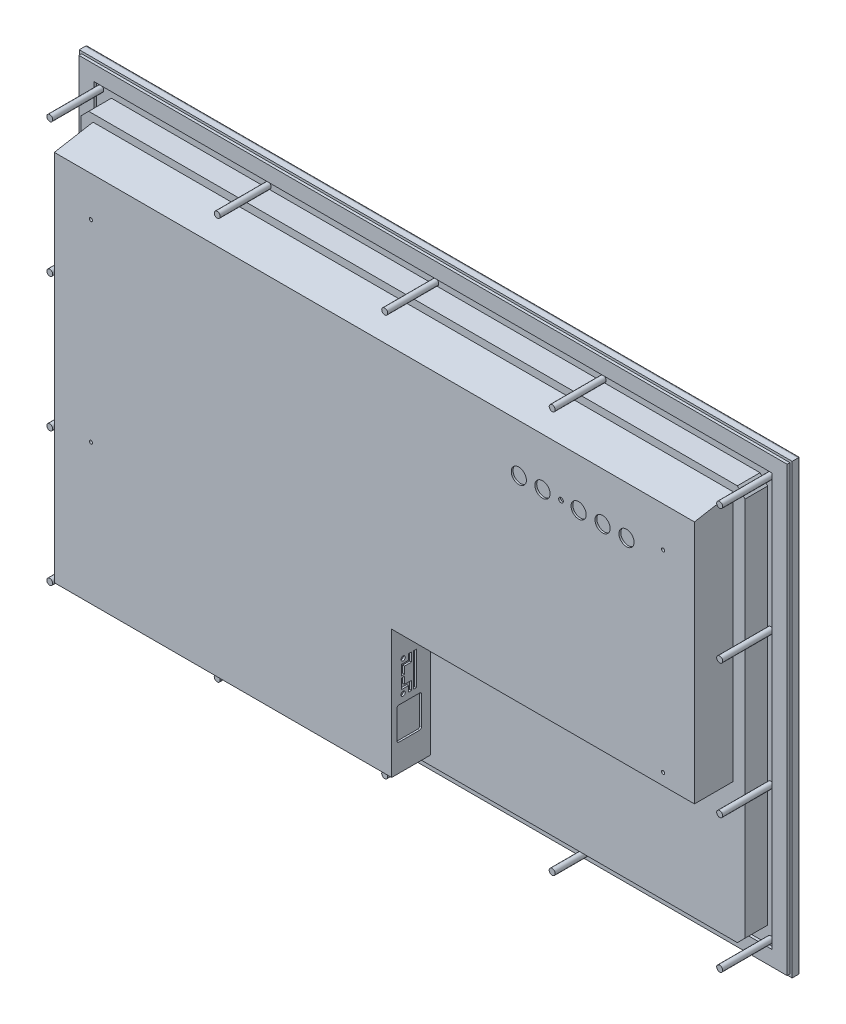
SolidWorks part; units mm, degrees
ref_plane "Front Plane" through (0, 0, 0) normal (0, 0, 1) x (1, 0, 0)
ref_plane "Top Plane" through (0, 0, 0) normal (0, 1, 0) x (1, 0, 0)
ref_plane "Right Plane" through (0, 0, 0) normal (1, 0, 0) x (0, 0, -1)
sketch "Sketch1" plane through (0, 0, 0) normal (0, 0, 1) x (1, 0, 0)
  line L0 (-298.45, 187.325) -> (298.45, 187.325)
  line L1 (298.45, 187.325) -> (298.45, -187.325)
  line L2 (298.45, -187.325) -> (-298.45, -187.325)
  line L3 (-298.45, -187.325) -> (-298.45, 187.325)
  point P2 (0, -187.325)
  point P3 (298.45, 0)
  dimension "D1" = 596.9
  dimension "D2" = 374.65
extrude "Bezel" add sketch "Sketch1" against normal blind 7.112
fillet "Bezel Radius" radius 2 4 edges at (0, -187.325, -7.112) (0, 187.325, -7.112) (-298.45, 0, -7.112) (298.45, 0, -7.112)
sketch "Sketch2" plane through (0, 0, -7.112) normal (0, 0, -1) x (-1, 0, 0)
  line L0 (-256.7686, 145.2626) -> (256.7686, 145.2626)
  line L1 (256.7686, 145.2626) -> (256.7686, -145.2626)
  line L2 (256.7686, -145.2626) -> (-256.7686, -145.2626)
  line L3 (-256.7686, -145.2626) -> (-256.7686, 145.2626)
  line L4 (296.45, 185.325) -> (-296.45, 185.325) construction
  line L5 (-296.45, 185.325) -> (-296.45, -185.325) construction
  point P0 (0, 145.2626)
  point P6 (0, 185.325)
  point P8 (-256.7686, 0)
  point P11 (-296.45, 0)
  dimension "D1" = 513.5372
  dimension "D2" = 290.5252
extrude "Window" cut sketch "Sketch2" against normal blind 2.35
sketch "Sketch3" plane through (0, 0, 0) normal (0, 0, 1) x (1, 0, 0)
  line L4 (-296.545, 185.42) -> (296.545, 185.42)
  line L5 (296.545, 185.42) -> (296.545, -185.42)
  line L6 (296.545, -185.42) -> (-296.545, -185.42)
  line L7 (-296.545, -185.42) -> (-296.545, 185.42)
  line L8 (298.45, 187.325) -> (-298.45, 187.325) construction
  line L9 (-298.45, 187.325) -> (-298.45, -187.325) construction
  line L10 (-298.45, -187.325) -> (298.45, -187.325) construction
  line L11 (298.45, -187.325) -> (298.45, 187.325) construction
  line L12 (-283.845, -172.72) -> (-283.845, 172.72)
  line L13 (-283.845, 172.72) -> (283.845, 172.72)
  line L14 (283.845, 172.72) -> (283.845, -172.72)
  line L15 (283.845, -172.72) -> (-283.845, -172.72)
  dimension "D1" = 1.905
  dimension "D2" = 1.905
  dimension "D3" = 1.905
  dimension "D4" = 1.905
  dimension "D5" = 12.7
extrude "Gasket" add sketch "Sketch3" along normal blind 2.3
sketch "Sketch5" plane through (0, 0, 0) normal (0, 0, 1) x (1, 0, 0)
  line L0 (-298.45, 187.325) -> (-298.45, -187.325) construction
  line L1 (298.45, 187.325) -> (-298.45, 187.325) construction
  circle A0 centre (-280.4668, 168.1226) radius 2.5
  circle A22 centre (-140.2334, 168.1226) radius 2.5
  circle A23 centre (-140.2334, -168.148) radius 2.5
  circle A24 centre (0, 168.1226) radius 2.5
  circle A25 centre (0, -168.148) radius 2.5
  circle A26 centre (140.2334, 168.1226) radius 2.5
  circle A27 centre (140.2334, -168.148) radius 2.5
  circle A28 centre (280.4668, 168.1226) radius 2.5
  circle A29 centre (280.4668, -168.148) radius 2.5
  circle A31 centre (-280.4668, -56.0578) radius 2.5
  circle A32 centre (-280.4668, -168.148) radius 2.5
  circle A33 centre (-280.4668, 56.0324) radius 2.5
  circle A34 centre (-280.4668, 56.0324) radius 2.5
  circle A35 centre (280.4668, 56.0324) radius 2.5
  circle A36 centre (-280.4668, -56.0578) radius 2.5
  circle A37 centre (280.4668, -56.0578) radius 2.5
  dimension "D1" = 5
  dimension "D2" = 17.9832
  dimension "D3" = 19.2024
  dimension "D4" = 3
  dimension "D5" = 140.2334
  dimension "D6" = 5
  dimension "D7" = 4
  dimension "D8" = 112.0902
extrude "Panel Frame Studs" add sketch "Sketch5" along normal blind 42.7
sketch "Sketch6" plane through (0, 0, 0) normal (0, 0, 1) x (1, 0, 0)
  line L0 (-277.9668, 159.2107) -> (-271.5549, 165.6226)
  line L1 (-271.5549, 165.6226) -> (271.5549, 165.6226)
  line L2 (271.5549, 165.6226) -> (277.9668, 159.2107)
  line L3 (277.9668, 159.2107) -> (277.9668, -159.2361)
  line L4 (277.9668, -159.2361) -> (271.5549, -165.648)
  line L5 (271.5549, -165.648) -> (-271.5549, -165.648)
  line L6 (-271.5549, -165.648) -> (-277.9668, -159.2361)
  line L7 (-277.9668, -159.2361) -> (-277.9668, 159.2107)
  circle A0 centre (-280.4668, 168.1226) radius 2.5 construction
  circle A6 centre (280.4668, 56.0324) radius 2.5 construction
  circle A7 centre (-140.2334, -168.148) radius 2.5 construction
  dimension "D1" = 9.0678
  dimension "D2" = 45
extrude "Body" add sketch "Sketch6" along normal blind 18.9738 separate body
sketch "Sketch7" plane through (0, 0, 18.9738) normal (0, 0, 1) x (1, 0, 0)
  line L0 (-267.97, 159.5374) -> (267.97, 159.5374)
  line L1 (267.97, 159.5374) -> (267.97, -50.673)
  line L2 (267.97, -50.673) -> (14.478, -50.673)
  line L3 (14.478, -50.673) -> (14.478, -158.242)
  line L4 (14.478, -158.242) -> (-267.97, -158.242)
  line L5 (-267.97, -158.242) -> (-267.97, 159.5374)
  line L6 (-271.5549, -165.648) -> (271.5549, -165.648) construction
  line L7 (-298.45, -187.325) -> (298.45, -187.325) construction
  line L9 (-277.9668, 159.2107) -> (-277.9668, -159.2361) construction
  point P3 (0, 159.5374)
  dimension "D1" = 535.94
  dimension "D2" = 210.2104
  dimension "D3" = 253.492
  dimension "D4" = 107.569
  dimension "D5" = 29.083
extrude "Rear Cover" add sketch "Sketch7" along normal blind 32.3596
draft "Rear Cover Slope" type of draft neutral plane draft angle 10 faces to draft 1 parameters "D1"=10
sketch "Sketch10" plane through (0, -50.673, 0) normal (0, 1, 0) x (1, 0, 0)
  line L4 (267.97, -51.3334) -> (267.97, -18.9738) construction
  line L5 (14.478, -18.9738) -> (267.97, -18.9738) construction
  line L53 (129.3253, -42.3233) -> (129.3253, -37.2433)
  line L54 (105.0493, -45.4958) -> (126.2773, -45.4958)
  line L55 (105.0493, -34.0709) -> (126.2773, -34.0709)
  line L56 (102.0013, -37.2433) -> (102.0013, -42.3233)
  line L57 (163.4683, -38.5006) -> (163.4683, -43.5806)
  line L58 (146.1963, -46.7531) -> (160.4203, -46.7531)
  line L59 (143.1483, -38.5006) -> (143.1483, -43.5806)
  line L60 (146.1963, -35.3282) -> (160.2927, -35.3256)
  line L61 (193.5581, -37.0782) -> (193.5581, -42.1582)
  line L62 (210.8301, -33.9058) -> (196.6061, -33.9058)
  line L63 (213.8781, -42.1582) -> (213.8781, -37.0782)
  line L64 (196.6061, -45.3307) -> (210.7025, -45.3332)
  line L65 (247.3255, -33.5095) -> (231.3235, -33.5095)
  line L66 (247.3255, -41.193) -> (247.3255, -45.7015)
  line L67 (231.3235, -45.7015) -> (247.3255, -45.7015)
  line L68 (231.3235, -41.193) -> (231.3235, -45.7015)
  line L69 (226.8785, -41.193) -> (231.3235, -41.193)
  line L70 (226.8785, -38.018) -> (231.3235, -38.018)
  line L71 (231.3235, -33.5095) -> (231.3235, -38.018)
  line L72 (247.3255, -38.018) -> (247.3255, -33.5095)
  line L73 (247.3255, -41.193) -> (251.7705, -41.193)
  line L74 (247.3255, -38.018) -> (251.7705, -38.018)
  circle A42 centre (131.9193, -39.7833) radius 1.5875
  arc A43 (129.3253, -42.3233) -> (126.2773, -45.4958) centre (126.1503, -42.3233) cw
  arc A44 (126.2773, -34.0709) -> (129.3253, -37.2433) centre (126.1503, -37.2433) cw
  arc A45 (102.0013, -37.2433) -> (105.0493, -34.0709) centre (105.1763, -37.2433) cw
  arc A46 (105.0493, -45.4958) -> (102.0013, -42.3233) centre (105.1763, -42.3233) cw
  circle A47 centre (99.4073, -39.7833) radius 1.5875
  arc A48 (146.1963, -46.7531) -> (143.1483, -43.5806) centre (146.3233, -43.5806) cw
  circle A49 centre (165.8083, -41.0533) radius 1.5875
  arc A50 (163.4683, -43.5806) -> (160.4203, -46.7531) centre (160.2933, -43.5806) cw
  circle A51 centre (140.8083, -41.0533) radius 1.5875
  arc A52 (143.1483, -38.5006) -> (146.1963, -35.3282) centre (146.3233, -38.5006) cw
  arc A53 (160.2927, -35.3256) -> (163.4683, -38.5006) centre (160.2933, -38.5006) cw
  circle A54 centre (191.2181, -39.6055) radius 1.5875
  arc A55 (193.5581, -37.0782) -> (196.6061, -33.9058) centre (196.7331, -37.0782) cw
  arc A56 (210.8301, -33.9058) -> (213.8781, -37.0782) centre (210.7031, -37.0782) cw
  arc A57 (213.8781, -42.1582) -> (210.7025, -45.3332) centre (210.7031, -42.1582) cw
  arc A58 (196.6061, -45.3307) -> (193.5581, -42.1582) centre (196.7331, -42.1582) cw
  circle A59 centre (216.2181, -39.6055) radius 1.5875
  arc A60 (226.8785, -41.193) -> (226.8785, -38.018) centre (226.8785, -39.6055) cw
  arc A61 (251.7705, -38.018) -> (251.7705, -41.193) centre (251.7705, -39.6055) cw
  dimension "D1" = 3.175
  dimension "D2" = 3.175
  dimension "D4" = 16.1995
  dimension "D5" = 20.6445
  dimension "D6" = 36.6465
  dimension "D7" = 51.7519
  dimension "D8" = 54.0919
  dimension "D9" = 57.1399
  dimension "D10" = 57.2675
  dimension "D11" = 104.5017
  dimension "D12" = 138.6447
  dimension "D13" = 141.6927
  dimension "D14" = 162.7937
  dimension "D15" = 76.7519
  dimension "D16" = 102.1617
  dimension "D17" = 14.5357
  dimension "D18" = 14.932
  dimension "D19" = 15.0971
  dimension "D20" = 16.3518
  dimension "D21" = 20.6317
  dimension "D22" = 23.1844
  dimension "D24" = 127.1617
  dimension "D25" = 136.0507
  dimension "D28" = 20.8095
  dimension "D29" = 22.0795
  dimension "D32" = 168.5627
extrude "Video / Touch Interface" cut sketch "Sketch10" along normal blind 1.524 from surface at 0
sketch "Sketch11" plane through (14.478, 0, 0) normal (-1, 0, 0) x (0, 0, 1)
  line L2 (37.2618, -103.4457) -> (37.2618, -98.6324)
  line L3 (37.2618, -103.4457) -> (34.7218, -103.4457)
  line L8 (34.7218, -103.4457) -> (34.7218, -96.0924)
  line L9 (33.1978, -75.5057) -> (33.1978, -103.4457)
  line L10 (33.1978, -103.4457) -> (30.6578, -103.4457)
  line L11 (30.6578, -103.4457) -> (30.6578, -75.5057)
  line L12 (30.6578, -75.5057) -> (33.1978, -75.5057)
  line L13 (34.7218, -75.5057) -> (37.2618, -75.5057)
  line L14 (37.2618, -75.5057) -> (37.2618, -80.319)
  line L15 (34.7218, -75.5057) -> (34.7218, -82.859)
  line L16 (34.7218, -82.859) -> (40.6146, -82.859)
  line L17 (37.2618, -80.319) -> (43.1546, -80.319)
  line L18 (43.1546, -80.319) -> (43.1546, -88.7137)
  line L19 (43.1546, -88.7137) -> (40.6146, -88.7137)
  line L20 (40.6146, -82.859) -> (40.6146, -88.7137)
  line L21 (40.6146, -90.2377) -> (43.1546, -90.2377)
  line L22 (43.1546, -98.6324) -> (43.1546, -90.2377)
  line L23 (40.6146, -90.2377) -> (40.6146, -96.0924)
  line L24 (34.7218, -96.0924) -> (40.6146, -96.0924)
  line L25 (37.2618, -98.6324) -> (43.1546, -98.6324)
  line L69 (26.4035, -110.1779) -> (26.4035, -134.1174)
  line L70 (27.9275, -108.6539) -> (45.3774, -108.6539)
  line L71 (46.9014, -134.1174) -> (46.9014, -110.1779)
  line L72 (45.3774, -135.6414) -> (27.9275, -135.6414)
  line L74 (18.9738, -158.242) -> (18.9738, -50.673) construction
  line L75 (51.3334, -50.673) -> (18.9738, -50.673) construction
  circle A0 centre (41.7576, -102.2646) radius 1.7907
  circle A1 centre (41.7576, -76.6868) radius 1.7907
  arc A14 (27.9275, -135.6414) -> (26.4035, -134.1174) centre (27.9275, -134.1174) cw
  arc A15 (26.4035, -110.1779) -> (27.9275, -108.6539) centre (27.9275, -110.1779) cw
  arc A16 (45.3774, -108.6539) -> (46.9014, -110.1779) centre (45.3774, -110.1779) cw
  arc A17 (46.9014, -134.1174) -> (45.3774, -135.6414) centre (45.3774, -134.1174) cw
  dimension "D1" = 3.5814
  dimension "D2" = 1.524
  dimension "D3" = 7.4297
  dimension "D4" = 15.748
  dimension "D5" = 21.6408
  dimension "D6" = 26.4036
  dimension "D7" = 26.0138
  dimension "D8" = 29.646
  dimension "D9" = 32.186
  dimension "D10" = 22.7838
  dimension "D11" = 38.0407
  dimension "D12" = 39.5647
  dimension "D13" = 51.5916
  dimension "D14" = 52.7727
  dimension "D15" = 57.9809
  dimension "D16" = 84.9684
  dimension "D17" = 11.684
  dimension "D18" = 18.288
extrude "Power AC and DC" cut sketch "Sketch11" along normal blind 1.524 from surface at 0
sketch "Sketch12" plane through (0, 0, 51.3334) normal (0, 0, 1) x (1, 0, 0)
  line L0 (-298.45, -187.325) -> (298.45, -187.325) construction
  line L1 (-298.45, 187.325) -> (-298.45, -187.325) construction
  circle A0 centre (120.9294, 113.7412) radius 6.35
  circle A1 centre (140.7414, 113.7412) radius 6.35
  circle A2 centre (170.9674, 113.7412) radius 6.35
  circle A3 centre (191.0334, 113.7412) radius 6.35
  circle A4 centre (156.2354, 113.7412) radius 1.9812
  circle A5 centre (211.0994, 113.7412) radius 6.35
  dimension "D8" = 301.0662
  dimension "D9" = 419.3794
  dimension "D4" = 20.066
  dimension "D6" = 12.7
  dimension "D7" = 3.9624
  dimension "D1" = 19.812
  dimension "D2" = 30.226
  dimension "D3" = 20.066
  dimension "D5" = 15.494
extrude "Controls Buttons" cut sketch "Sketch12" against normal blind 1.524 from surface at 0
hole_wizard "6-32 Accessory Bracket Holes" positions "Sketch13" profile "Sketch14" hole size "#6-32" standard "ANSI Inch"
sketch "Sketch13" plane through (0, 0, 51.3334) normal (0, 0, 1) x (1, 0, 0)
  line L0 (-298.45, 187.325) -> (-298.45, -187.325) construction
  line L1 (-298.45, -187.325) -> (298.45, -187.325) construction
  point P0 (-237.3122, -40.9956)
  point P2 (-237.3122, 120.3452)
  point P4 (241.7318, 120.3452)
  point P6 (241.7318, -40.9956)
  dimension "D1" = 161.3408
  dimension "D2" = 479.044
  dimension "D3" = 61.1378
  dimension "D4" = 146.3294
sketch "Sketch14" plane through (-237.3122, -40.9956, 51.3334) normal (1, 0, 0) x (0, -1, 0)
  line L0 (0, 0) -> (0, 16.8147)
  line L1 (0, 16.8147) -> (1.3525, 16.002)
  line L2 (1.3525, 16.002) -> (1.3525, 0)
  line L5 (1.3525, 0) -> (0, 0)
  line L10 (0, 16.8147) -> (-1.3526, 16.002) construction
  line L11 (0, -6.35) -> (0, 107.95) construction
  dimension "Hole Dia." = 2.7051
  dimension "Hole Depth" = 16.002
  dimension "Drill Angle" = 118
